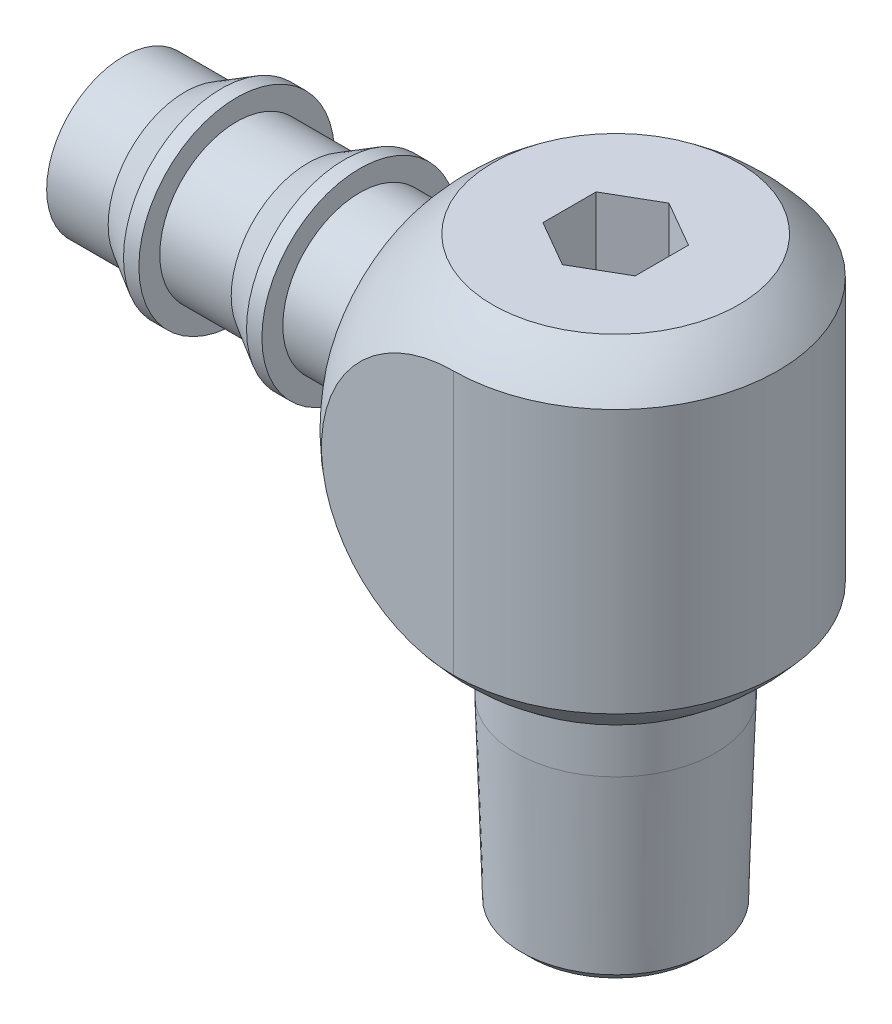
SolidWorks part; units mm, degrees
ref_plane "Front Plane" through (0, 0, 0) normal (0, 0, 1) x (1, 0, 0)
ref_plane "Top Plane" through (0, 0, 0) normal (0, 1, 0) x (1, 0, 0)
ref_plane "Right Plane" through (0, 0, 0) normal (1, 0, 0) x (0, 0, -1)
ref_plane "Plane1" through (0, 14.7256, 0) normal (0, 1, 0) x (-1, 0, 0)
sketch "Sketch1" plane through (0, 0, 0) normal (0, 0, 1) x (1, 0, 0)
  line L0 (0, 0) -> (0, 50000) construction
  line L1 (0, 25.5206) -> (0, 3.9307)
  line L2 (9.2202, 14.7256) -> (-9.2202, 14.7256) construction
  arc A1 (0, 3.9307) -> (0, 25.5206) centre (0, 14.7256) ccw
  dimension "D1" = 21.59
revolve "Revolve1" add sketch "Sketch1" angle 360 about L0
sketch "Sketch3" plane through (0, 0, 0) normal (0, 1, 0) x (1, 0, 0)
  line L0 (2.5806, 0) -> (50002.5806, 0) construction
  line L1 (0, -8.382) -> (-8.382, -8.382)
  line L2 (-8.382, -8.382) -> (-8.382, 8.382)
  line L3 (0, 8.382) -> (-8.382, 8.382)
  circle A0 centre (0, 0) radius 8.382 construction
  arc A1 (0, -8.382) -> (0, 8.382) centre (0, 0) ccw
  point P12 (-8.382, 0)
  dimension "D1" = 16.764
extrude "Cut-Extrude1" cut sketch "Sketch3" against normal through all and the other way through all flip side to cut
sketch "Sketch4" plane through (0, 0, 0) normal (0, 0, 1) x (1, 0, 0)
  line L0 (0, 0) -> (0, 50000) construction
  line L1 (-12.7, 23.4569) -> (12.7, 23.4569)
  line L2 (-12.7, 23.4569) -> (-12.7, 5.9944)
  line L3 (-12.7, 5.9944) -> (12.7, 5.9944)
  line L4 (12.7, 23.4569) -> (12.7, 5.9944)
  line L5 (0, 7.9231) -> (0, 21.5282) construction
  line L6 (0, 14.7256) -> (50000, 14.7256) construction
  line L7 (9.2202, 14.7256) -> (-9.2202, 14.7256) construction
  point P8 (0, 14.7256)
  dimension "D1" = 17.4625
  dimension "D2" = 25.4
extrude "Cut-Extrude2" cut sketch "Sketch4" against normal through all and the other way through all flip side to cut
sketch "Sketch9" plane through (0, 14.7256, 0) normal (0, 1, 0) x (1, 0, 0)
  line L0 (0, 0) -> (50000, 0) construction
  line L1 (-25.4, 0) -> (-25.4, 3.9688)
  line L2 (-25.4, 3.9688) -> (-22.225, 3.9688)
  line L3 (-22.225, 3.9688) -> (-20.3553, 5.0482)
  line L4 (-20.3553, 5.0482) -> (-19.5615, 5.0482)
  line L5 (-19.5615, 5.0482) -> (-19.5615, 3.9688)
  line L6 (-19.5615, 3.9688) -> (-15.875, 3.9688)
  line L7 (-15.875, 3.9688) -> (-14.0053, 5.0482)
  line L8 (-14.0053, 5.0482) -> (-13.2115, 5.0482)
  line L9 (-13.2115, 5.0482) -> (-13.2115, 3.9688)
  line L10 (-13.2115, 3.9688) -> (0, 3.9688)
  line L11 (0, 3.9688) -> (0, 0)
  line L12 (-25.4, 0) -> (0, 0)
  line L13 (0, 0) -> (0, 50000) construction
  dimension "D1" = 7.9375
  dimension "D2" = 1.0795
  dimension "D4" = 15.875
  dimension "D5" = 3.175
  dimension "D6" = 25.4
  dimension "D7" = 0.7937
  dimension "D8" = 30
revolve "Revolve2" add sketch "Sketch9" angle 360 about L0
fillet "Fillet1" radius 0.7937 1 edges at (-8.382, 14.7256, -3.9688)
sketch "Sketch10" plane through (-25.4, 0, 0) normal (-1, 0, 0) x (0, 0, 1)
  circle A0 centre (0, 14.7256) radius 2.6988
  circle A1 centre (0, 14.7256) radius 3.9688 construction
  circle A2 centre (0, 14.7256) radius 3.9688 construction
  dimension "D1" = 1.27
extrude "Cut-Extrude3" cut sketch "Sketch10" against normal up to surface (25.4 mm away)
sketch "Sketch11" plane through (0, 0, 0) normal (0, 0, 1) x (1, 0, 0)
  line L4 (0, -15.7116) -> (0, 49984.2884) construction
  line L5 (4.8608, -6.2263) -> (5.1435, 2.8194)
  line L6 (0, -6.7056) -> (4.3815, -6.7056)
  line L7 (4.3815, -6.7056) -> (4.8608, -6.2263)
  line L9 (5.1435, 2.8194) -> (5.1435, 5.9944)
  line L10 (-6.348, 5.9944) -> (6.348, 5.9944) construction
  line L11 (0, 5.9944) -> (5.1435, 5.9944)
  line L12 (0, 5.9944) -> (0, -6.7056)
  dimension "D1" = 12.7
  dimension "D2" = 1.79
  dimension "D3" = 45
  dimension "D4" = 10.287
  dimension "D5" = 3.175
  dimension "D6" = 0.762
revolve "Revolve3" add sketch "Sketch11" angle 360 about L4
sketch "Sketch12" plane through (0, -6.7056, 0) normal (0, -1, 0) x (1, 0, 0)
  circle A1 centre (0, 0) radius 3.175
  circle A2 centre (0, 0) radius 5.1435 construction
  dimension "D1" = 6.35
extrude "Cut-Extrude4" cut sketch "Sketch12" against normal blind 24.13
sketch "Sketch13" plane through (0, 23.4569, 0) normal (0, 1, 0) x (1, 0, 0)
  line L1 (0, 2.7496) -> (-2.3812, 1.3748)
  line L2 (-2.3812, 1.3748) -> (-2.3812, -1.3748)
  line L3 (-2.3812, -1.3748) -> (0, -2.7496)
  line L4 (0, -2.7496) -> (2.3813, -1.3748)
  line L5 (2.3813, -1.3748) -> (2.3813, 1.3748)
  line L6 (2.3813, 1.3748) -> (0, 2.7496)
  line L7 (0, -55) -> (0, 55) construction
  circle A0 centre (0, 0) radius 2.3812 construction
  dimension "D1" = 4.7625
extrude "Cut-Extrude5" cut sketch "Sketch13" against normal blind 3.9688
